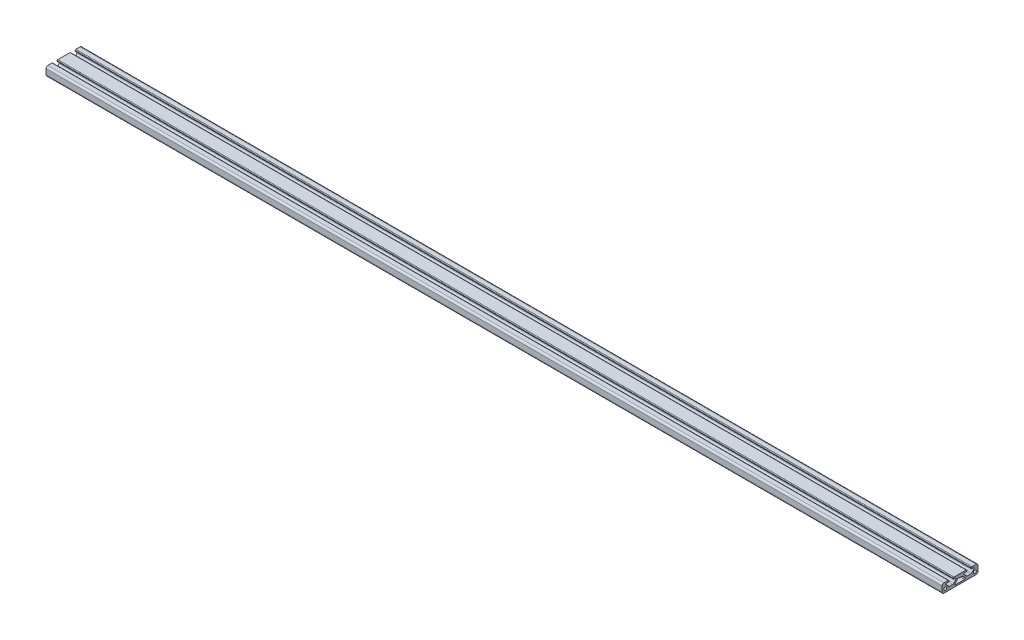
SolidWorks part; units mm, degrees
ref_plane "Ebene vorne" through (0, 0, 0) normal (0, 0, 1) x (1, 0, 0)
ref_plane "Ebene oben" through (0, 0, 0) normal (0, 1, 0) x (1, 0, 0)
ref_plane "Ebene rechts" through (0, 0, 0) normal (1, 0, 0) x (0, 0, -1)
sketch "Skizze1" plane through (0, 0, 0) normal (0, 1, 0) x (1, 0, 0)
  line L0 (0, 0) -> (1000, 0)
  dimension "D1" = 1000
other "Strukturbauteil1"
ref_plane "Ebene1" through (0, 0, 0) normal (1, 0, 0) x (0, 0, -1)
sketch "Model" plane through (0, 0, 0) normal (1, 0, 0) x (0, 0, -1)
  line L0 (7, 3.2) -> (4.9899, 3.2)
  line L1 (8.1992, -1.35) -> (11.8008, -1.35)
  line L2 (15.0101, 3.2) -> (13, 3.2)
  line L3 (12.5, 3.7) -> (12.5, 4.25)
  line L4 (13.25, 5) -> (18, 5)
  line L5 (20, 3) -> (20, -3)
  line L6 (18, -5) -> (-18, -5)
  line L7 (-20, -3) -> (-20, 3)
  line L8 (-18, 5) -> (-13.25, 5)
  line L9 (-12.5, 4.25) -> (-12.5, 3.7)
  line L10 (-13, 3.2) -> (-15.0101, 3.2)
  line L11 (-11.8008, -1.35) -> (-8.1992, -1.35)
  line L12 (-4.9899, 3.2) -> (-7, 3.2)
  line L13 (-7.5, 3.7) -> (-7.5, 4.25)
  line L14 (-6.75, 5) -> (6.75, 5)
  line L15 (7.5, 4.25) -> (7.5, 3.7)
  line L16 (-5.0023, -3.3) -> (5.0023, -3.3)
  line L17 (1.8125, 1.25) -> (-1.8125, 1.25)
  line L18 (-4.3641, 2.0653) -> (-5.5207, 0.5036)
  line L19 (-20, 5) -> (20, 5) construction
  line L20 (-20, 5) -> (-20, -5) construction
  line L21 (-20, -5) -> (20, -5) construction
  line L22 (20, 5) -> (20, -5) construction
  line L23 (-20, 5) -> (20, -5) construction
  line L24 (-20, -5) -> (20, 5) construction
  line L25 (-5.5207, 0.5036) -> (-6.8972, -0.8682)
  line L26 (-13.1028, -0.8682) -> (-14.4793, 0.5036)
  line L27 (-14.4793, 0.5036) -> (-15.6359, 2.0653)
  line L28 (-3.1166, 0.7664) -> (-4.4845, -0.5996)
  line L29 (-4.4845, -0.5996) -> (-5.6347, -2.1533)
  line L30 (3.1166, 0.7664) -> (4.4845, -0.5996)
  line L31 (4.4845, -0.5996) -> (5.6347, -2.1533)
  line L32 (4.3641, 2.0653) -> (5.5207, 0.5036)
  line L33 (5.5207, 0.5036) -> (6.8972, -0.8682)
  line L34 (13.1028, -0.8682) -> (14.4793, 0.5036)
  line L35 (14.4793, 0.5036) -> (15.6359, 2.0653)
  circle A0 centre (-16.5, -1.5) radius 1.65
  circle A1 centre (16.5, -1.5) radius 1.65
  arc A2 (7, 3.2) -> (7.5, 3.7) centre (7, 3.7) ccw
  arc A3 (4.9899, 3.2) -> (4.3641, 2.0653) centre (4.9899, 2.4601) ccw
  arc A5 (6.8972, -0.8682) -> (8.1992, -1.35) centre (8.1992, 0.65) ccw
  arc A6 (11.8008, -1.35) -> (13.1028, -0.8682) centre (11.8008, 0.65) ccw
  arc A8 (15.6359, 2.0653) -> (15.0101, 3.2) centre (15.0101, 2.4601) ccw
  arc A9 (12.5, 3.7) -> (13, 3.2) centre (13, 3.7) ccw
  arc A10 (13.25, 5) -> (12.5, 4.25) centre (13.25, 4.25) ccw
  arc A11 (20, 3) -> (18, 5) centre (18, 3) ccw
  arc A12 (18, -5) -> (20, -3) centre (18, -3) ccw
  arc A13 (-20, -3) -> (-18, -5) centre (-18, -3) ccw
  arc A14 (-18, 5) -> (-20, 3) centre (-18, 3) ccw
  arc A15 (-12.5, 4.25) -> (-13.25, 5) centre (-13.25, 4.25) ccw
  arc A16 (-13, 3.2) -> (-12.5, 3.7) centre (-13, 3.7) ccw
  arc A17 (-15.0101, 3.2) -> (-15.6359, 2.0653) centre (-15.0101, 2.4601) ccw
  arc A19 (-13.1028, -0.8682) -> (-11.8008, -1.35) centre (-11.8008, 0.65) ccw
  arc A20 (-8.1992, -1.35) -> (-6.8972, -0.8682) centre (-8.1992, 0.65) ccw
  arc A22 (-4.3641, 2.0653) -> (-4.9899, 3.2) centre (-4.9899, 2.4601) ccw
  arc A23 (-7.5, 3.7) -> (-7, 3.2) centre (-7, 3.7) ccw
  arc A24 (-6.75, 5) -> (-7.5, 4.25) centre (-6.75, 4.25) ccw
  arc A25 (7.5, 4.25) -> (6.75, 5) centre (6.75, 4.25) ccw
  arc A26 (-5.6347, -2.1533) -> (-5.0023, -3.3) centre (-5.0023, -2.5523) ccw
  arc A27 (5.0023, -3.3) -> (5.6347, -2.1533) centre (5.0023, -2.5523) ccw
  arc A29 (3.1166, 0.7664) -> (1.8125, 1.25) centre (1.8125, -0.75) ccw
  arc A30 (-1.8125, 1.25) -> (-3.1166, 0.7664) centre (-1.8125, -0.75) ccw
  point P10 (0, 0)
  point P82 (0, 0)
  point P88 (-10, 5)
  point P89 (10, 5)
